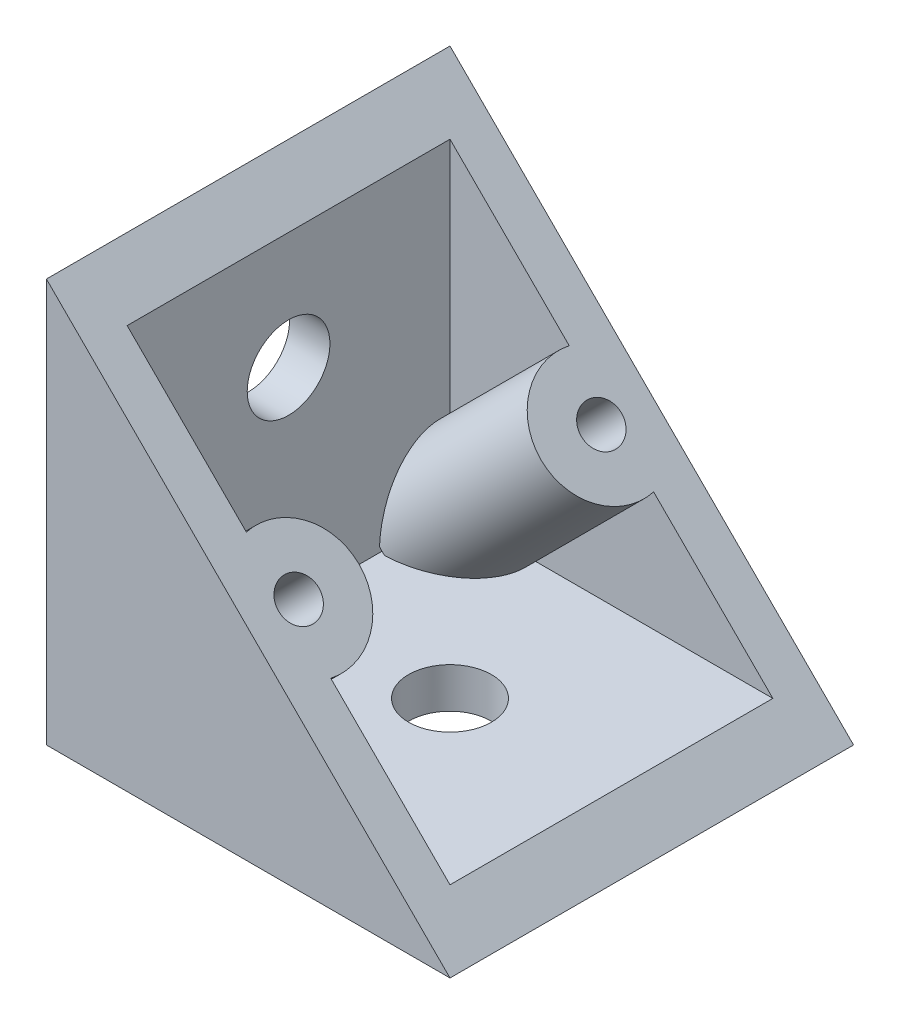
SolidWorks part; units mm, degrees
ref_plane "Alzado" through (0, 0, 0) normal (0, 0, 1) x (1, 0, 0)
ref_plane "Planta" through (0, 0, 0) normal (0, 1, 0) x (1, 0, 0)
ref_plane "Vista lateral" through (0, 0, 0) normal (1, 0, 0) x (0, 0, -1)
sketch "Croquis1" plane through (0, 0, 0) normal (0, 0, 1) x (1, 0, 0)
  line L0 (0, 0) -> (40, 0)
  line L1 (0, 0) -> (0, 40)
  line L2 (0, 40) -> (40, 0)
extrude "Extruir1" add sketch "Croquis1" along normal blind 40
sketch "Croquis2" plane through (20, 20, 0) normal (0.7071, 0.7071, 0) x (0, 0, -1)
  point P0 (-5, 0)
  point P1 (-35, 0)
hole_wizard "Taladro de diámetro de Ø4.0 (4)1" positions "Croquis3D1" profile "Croquis3" hole size "Ø4.0" standard "ISO"
sketch3d "Croquis3D1"
  point P0 (20, 20, 35)
  point P3 (20, 20, 5)
sketch "Croquis3" plane through (20, 20, 35) normal (0, 0, 1) x (-0.7071, 0.7071, 0)
  line L0 (0, 0) -> (0, 21.2017)
  line L1 (0, 21.2017) -> (2, 20)
  line L2 (2, 20) -> (2, 0)
  line L5 (2, 0) -> (0, 0)
  line L10 (0, 21.2017) -> (-2, 20) construction
  line L11 (0, -6.35) -> (0, 107.95) construction
  dimension "Diámetro de taladro" = 4
  dimension "Profundidad de taladro" = 20
  dimension "Ángulo de perforador" = 118
shell "Vaciado1" thickness 4
sketch "Croquis4" plane through (0, 0, 0) normal (-1, 0, 0) x (0, 0, 1)
  point P0 (20, 24.3981)
hole_wizard "Taladro de diámetro de Ø8.2 (8.2)1" positions "Croquis3D2" profile "Croquis5" hole size "Ø8.2" standard "ISO"
sketch3d "Croquis3D2"
  point P0 (0, 24.3981, 20)
sketch "Croquis5" plane through (0, 24.3981, 20) normal (0, 1, 0) x (0, 0, 1)
  line L0 (0, 0) -> (0, 40)
  line L1 (0, 40) -> (4.1, 40)
  line L2 (4.1, 40) -> (4.1, 0)
  line L5 (4.1, 0) -> (0, 0)
  line L11 (0, -6.35) -> (0, 107.95) construction
  dimension "Diámetro de taladro hasta el siguiente" = 8.2
  dimension "Profundidad de taladro hasta el siguiente" = 40
sketch "Croquis6" plane through (0, 0, 0) normal (0, -1, 0) x (1, 0, 0)
  point P0 (20, 20)
hole_wizard "Taladro de diámetro de Ø8.2 (8.2)2" positions "Croquis3D3" profile "Croquis8" hole size "Ø8.2" standard "ISO"
sketch3d "Croquis3D3"
  point P0 (20, 0, 20)
sketch "Croquis8" plane through (20, 0, 20) normal (1, 0, 0) x (0, 0, -1)
  line L0 (0, 0) -> (0, 40)
  line L1 (0, 40) -> (4.1, 40)
  line L2 (4.1, 40) -> (4.1, 0)
  line L5 (4.1, 0) -> (0, 0)
  line L11 (0, -6.35) -> (0, 107.95) construction
  dimension "Diámetro de taladro hasta el siguiente" = 8.2
  dimension "Profundidad de taladro hasta el siguiente" = 40
sketch "Croquis9" plane through (0, 0, 0) normal (-1, 0, 0) x (0, 0, 1)
  line L0 (16, 29) -> (24, 29)
  line L1 (16, 31) -> (24, 31)
  line L2 (16, 29) -> (16, 31)
  line L3 (24, 31) -> (24, 29)
  line L4 (16, 11) -> (24, 11)
  line L5 (24, 11) -> (24, 9)
  line L6 (24, 9) -> (16, 9)
  line L7 (16, 9) -> (16, 11)
extrude "Extruir2" add sketch "Croquis9" along normal blind 3
sketch "Croquis10" plane through (0, 0, 0) normal (0, -1, 0) x (1, 0, 0)
  line L0 (9, 24) -> (9, 16)
  line L1 (9, 16) -> (11, 16)
  line L2 (11, 16) -> (11, 24)
  line L3 (11, 24) -> (9, 24)
  line L4 (31, 24) -> (31, 16)
  line L5 (31, 16) -> (29, 16)
  line L6 (29, 16) -> (29, 24)
  line L7 (31, 24) -> (29, 24)
extrude "Extruir3" add sketch "Croquis10" along normal blind 3
